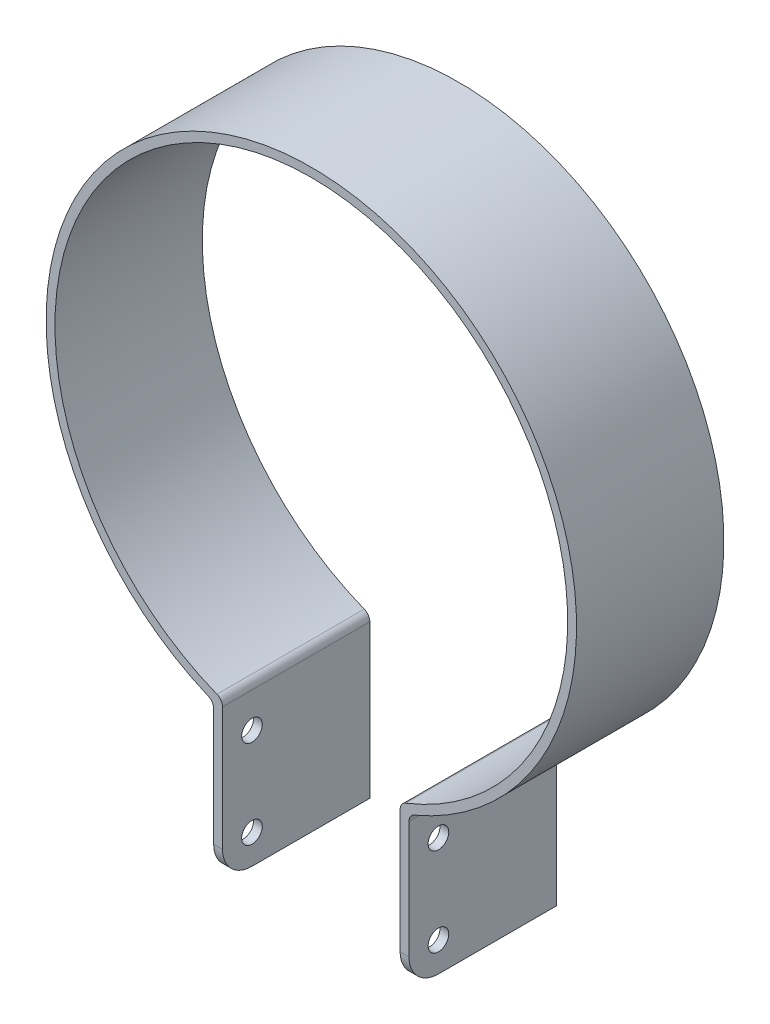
SolidWorks part; units mm, degrees
ref_plane "Front Plane" through (0, 0, 0) normal (0, 0, 1) x (1, 0, 0)
ref_plane "Top Plane" through (0, 0, 0) normal (0, 1, 0) x (1, 0, 0)
ref_plane "Right Plane" through (0, 0, 0) normal (1, 0, 0) x (0, 0, -1)
sketch "Sketch1" plane through (0, 0, 0) normal (0, 0, 1) x (1, 0, 0)
  line L0 (0, 0) -> (0, -67.7668) construction
  line L1 (-15.07, -41.8382) -> (-15.07, -67.7668)
  line L2 (15.07, -41.8382) -> (15.07, -67.7668)
  line L3 (15.07, 0) -> (15.07, -67.7668) construction
  line L4 (-15.07, 0) -> (-15.07, -67.7668) construction
  line L5 (-16.57, -42.8454) -> (-16.57, -67.7668)
  line L6 (16.57, -42.8454) -> (16.57, -67.7668)
  line L7 (16.57, -42.4016) -> (16.57, -67.7668) construction
  line L8 (15.07, -42.4016) -> (15.07, -67.7668) construction
  line L9 (-15.07, -42.4016) -> (-15.07, -67.7668) construction
  line L10 (-16.57, -42.4016) -> (-16.57, -67.7668) construction
  line L11 (-16.57, -67.7668) -> (-15.07, -67.7668)
  line L12 (15.07, -67.7668) -> (16.57, -67.7668)
  arc A0 (17.4871, -41.4633) -> (-17.4871, -41.4633) centre (0, 0) ccw
  arc A1 (16.0177, -40.4436) -> (-16.0177, -40.4436) centre (0, 0) ccw
  arc A2 (14.5677, -40.9882) -> (-14.5677, -40.9882) centre (0, 0) ccw construction
  arc A3 (15.07, -42.4016) -> (-15.07, -42.4016) centre (0, 0) ccw construction
  arc A4 (16.57, -42.8454) -> (17.4871, -41.4633) centre (18.07, -42.8454) cw
  arc A5 (15.07, -41.8382) -> (16.0177, -40.4436) centre (16.57, -41.8382) cw
  arc A6 (-16.57, -42.8454) -> (-17.4871, -41.4633) centre (-18.07, -42.8454) ccw
  arc A7 (-15.07, -41.8382) -> (-16.0177, -40.4436) centre (-16.57, -41.8382) ccw
  dimension "D1" = 90
  dimension "D4" = 1.5
  dimension "D2" = 15.07
  dimension "D3" = 15.07
  dimension "D5" = 1.5
  dimension "D6" = 1.5
  dimension "D7" = 1.5
extrude "Extrude1" add sketch "Sketch1" along normal blind 25
fillet "Fillet1" radius 5 2 edges at (15.82, -67.7668, 25) (-15.82, -67.7668, 25)
sketch "Sketch2" plane through (16.57, 0, 0) normal (1, 0, 0) x (0, 0, -1)
  line L1 (-20, -47.7668) -> (-20, -62.7668) construction
  circle A0 centre (-20, -47.7668) radius 1.75
  circle A1 centre (-20, -62.7668) radius 1.75
  arc A2 (-25, -62.7668) -> (-20, -67.7668) centre (-20, -62.7668) ccw construction
  dimension "D1" = 3.5
  dimension "D3" = 15
extrude "Extrude2" cut sketch "Sketch2" against normal through all
